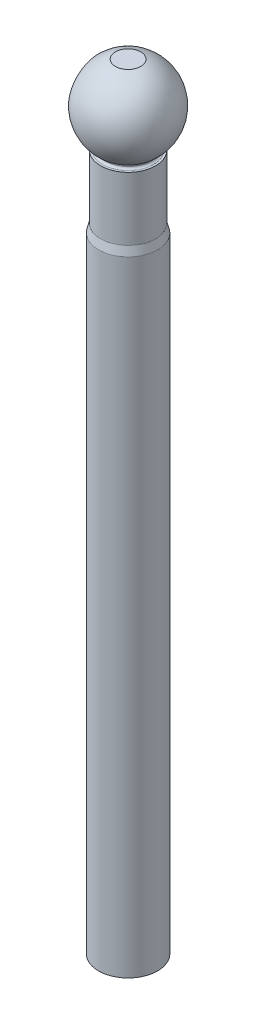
SolidWorks part; units mm, degrees
ref_plane "Face" through (0, 0, 0) normal (0, 0, 1) x (1, 0, 0)
ref_plane "Dessus" through (0, 0, 0) normal (0, 1, 0) x (1, 0, 0)
ref_plane "Droite" through (0, 0, 0) normal (1, 0, 0) x (0, 0, -1)
sketch "Esquisse1" plane through (0, 0, 0) normal (0, 0, 1) x (1, 0, 0)
  line L0 (0, 88.2813) -> (0, -88.2813) construction
  line L1 (0, 9.5394) -> (3, 9.5394)
  line L2 (6.5, -24.0993) -> (7, -24.0993)
  line L3 (7, -24.0993) -> (7, -174.0993)
  line L4 (7, -174.0993) -> (0, -174.0993)
  line L5 (0, -174.0993) -> (0, 9.5394)
  line L6 (6.5, -7.5993) -> (5.5, -7.5993)
  line L7 (6.5, -9.0993) -> (6.5, -24.0993)
  line L8 (6.5, -9.0993) -> (5.5, -9.0993)
  line L9 (5.5, -7.5993) -> (5.5, -9.0993)
  arc A0 (6.5, -7.5993) -> (3, 9.5394) centre (0, 0) ccw
  dimension "D1" = 10
  dimension "D2" = 6.5
  dimension "D3" = 7
  dimension "D4" = 150
  dimension "D5" = 15
  dimension "D6" = 1.5
  dimension "D7" = 1
  dimension "D8" = 3
revolve "Base-Révolution" add sketch "Esquisse1" angle 360 about L0
chamfer "Chanfrein1" distance 2 distance2 0.5
fillet "Congé1" radius 0.5
sketch "Esquisse2" plane through (0, 0, 0) normal (0, 1, 0) x (1, 0, 0)
  line L1 (-12.2535, 9.8649) -> (-7, 9.8649)
  line L2 (-12.2535, 9.8649) -> (-12.2535, -10.4487)
  line L3 (-12.2535, -10.4487) -> (-7, -10.4487)
  line L4 (-7, 9.8649) -> (-7, -10.4487)
  dimension "D1" = 7
extrude "Enlèv. mat.-Extru.1" cut sketch "Esquisse2" against normal up to next and the other way up to next
sketch "Esquisse3" plane through (-7, 0, 0) normal (-1, 0, 0) x (0, 0, 1)
  circle A0 centre (0, 0) radius 6.5
  dimension "D1" = 13
extrude "Enlèv. mat.-Extru.2" cut sketch "Esquisse3" against normal blind 5
sketch "Esquisse4" plane through (0, 0, 0) normal (0, 1, 0) x (1, 0, 0)
  line L0 (-9.8991, 0) -> (13.9947, 0) construction
  line L1 (-2, 0) -> (-7, 0) construction
  line L2 (-6.5, 0) -> (6.5, 0)
  arc A0 (6.5, 0) -> (-6.5, 0) centre (0, 0) ccw
  dimension "D1" = 13
revolve "Enlèvement de matière-Révolution1" cut sketch "Esquisse4" angle 360 about L0
